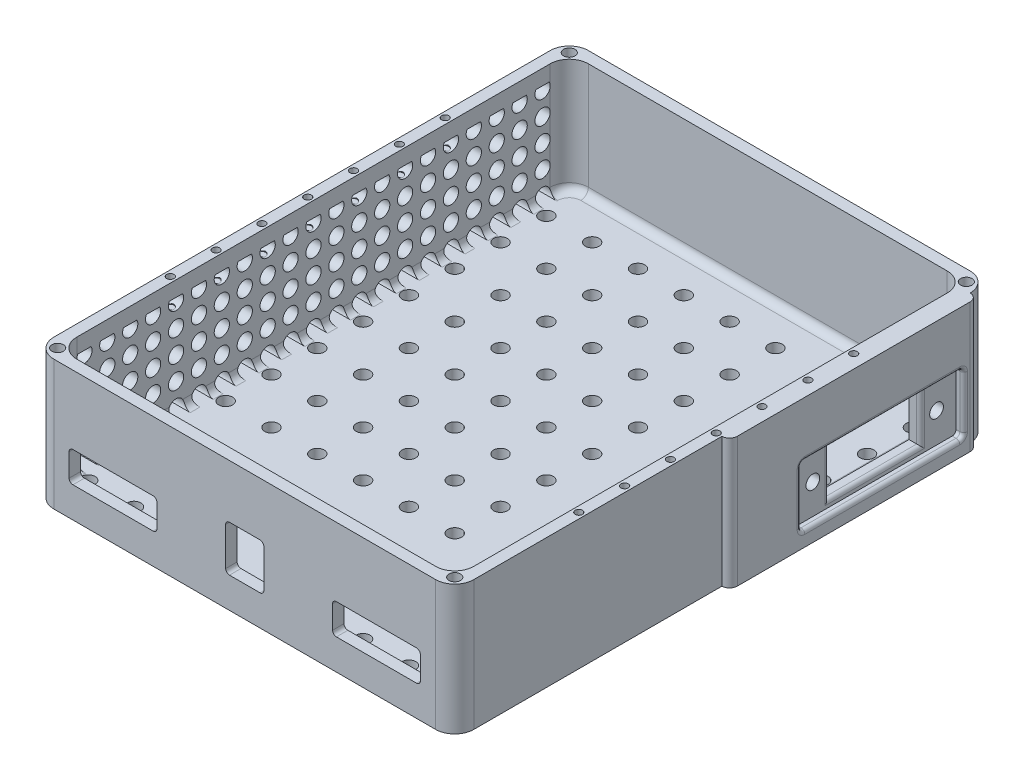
SolidWorks part; units mm, degrees
ref_plane "Front Plane" through (0, 0, 0) normal (0, 0, 1) x (1, 0, 0)
ref_plane "Top Plane" through (0, 0, 0) normal (0, 1, 0) x (1, 0, 0)
ref_plane "Right Plane" through (0, 0, 0) normal (1, 0, 0) x (0, 0, -1)
sketch "Sketch1" plane through (0, 0, 0) normal (0, 1, 0) x (1, 0, 0)
  line L1 (-55, 70) -> (55, 70)
  line L2 (-55, 70) -> (-55, -70)
  line L3 (-55, -70) -> (55, -70)
  line L4 (55, 70) -> (55, -70)
  line L5 (-55, 70) -> (55, -70) construction
  line L6 (-55, -70) -> (55, 70) construction
  point P0 (0, 0)
  dimension "D1" = 110
  dimension "D2" = 140
extrude "Boss-Extrude1" add sketch "Sketch1" along normal blind 4
sketch "Sketch3" plane through (0, 4, 0) normal (0, 1, 0) x (1, 0, 0)
  line L5 (-55, 70) -> (55, 70)
  line L6 (-55, 70) -> (-55, -70)
  line L7 (-55, -70) -> (55, -70)
  line L8 (52, -67) -> (52, 67)
  line L9 (52, 67) -> (-52, 67)
  line L10 (-52, 67) -> (-52, -67)
  line L11 (-52, -67) -> (52, -67)
  line L12 (52, -67) -> (52, 67)
  line L13 (52, 67) -> (-52, 67)
  line L14 (-52, 67) -> (-52, -67)
  line L15 (-52, -67) -> (52, -67)
  line L16 (55, 70) -> (55, -70)
  line L17 (-55, 70) -> (55, -70) construction
  line L18 (-55, -70) -> (55, 70) construction
  point P0 (0, 0)
  dimension "D1" = 3
extrude "Boss-Extrude2" add sketch "Sketch3" along normal blind 30
fillet "Fillet1" radius 5 8 edges at (55, 17, 70) (-55, 17, 70) (-52, 19, 67) (52, 19, 67) (55, 17, -70) (-55, 17, -70) (-52, 19, -67) (52, 19, -67)
sketch "Sketch5" plane through (0, 34, 0) normal (0, 1, 0) x (1, 0, 0)
  line L0 (-53.5355, 68.5355) -> (-50.5355, 65.5355)
  arc A2 (-50, 70) -> (-55, 65) centre (-50, 65) ccw construction
  arc A3 (-47, 67) -> (-52, 62) centre (-47, 62) ccw construction
  circle A4 centre (-52.0355, 67.0355) radius 1.5
  circle A5 centre (51.9645, 67.0355) radius 1.5
  circle A6 centre (51.9645, -66.9645) radius 1.5
  circle A7 centre (-52.0355, -66.9645) radius 1.5
  dimension "D1" = 3
  dimension "D2" = 2
  dimension "D3" = 2
extrude "Cut-Extrude2" cut sketch "Sketch5" against normal blind 7 contours A7 | A6 | A5 | A4
sketch "Sketch6" plane through (0, 34, 0) normal (0, 1, 0) x (1, 0, 0)
  line L0 (-52, 0) -> (-55, 0)
  line L1 (-52, 62) -> (-52, -62) construction
  line L2 (-55, 65) -> (-55, -65) construction
  line L3 (0, 67) -> (0, -67)
  line L4 (47, 67) -> (-47, 67) construction
  line L5 (-47, -67) -> (47, -67) construction
  circle A0 centre (-53.5, 0) radius 0.95
  circle A1 centre (-53.5, -12) radius 0.95
  circle A2 centre (-53.5, -24) radius 0.95
  circle A3 centre (-53.5, -36) radius 0.95
  circle A4 centre (-53.5, 0) radius 0.95
  circle A5 centre (-53.5, -12) radius 0.95
  circle A6 centre (-53.5, -24) radius 0.95
  circle A7 centre (-53.5, 12) radius 0.95
  circle A8 centre (-53.5, 0) radius 0.95
  circle A9 centre (-53.5, -12) radius 0.95
  circle A10 centre (-53.5, 24) radius 0.95
  circle A11 centre (-53.5, 12) radius 0.95
  circle A12 centre (-53.5, 0) radius 0.95
  circle A13 centre (-53.5, 12) radius 0.95
  circle A14 centre (-53.5, 24) radius 0.95
  circle A15 centre (-53.5, 36) radius 0.95
  circle A16 centre (53.5, -36) radius 0.95
  circle A17 centre (53.5, -24) radius 0.95
  circle A18 centre (53.5, -12) radius 0.95
  circle A19 centre (53.5, 0) radius 0.95
  circle A20 centre (53.5, 12) radius 0.95
  circle A21 centre (53.5, 24) radius 0.95
  circle A22 centre (53.5, 36) radius 0.95
  dimension "D1" = 1.9
  dimension "D2" = 4
  dimension "D3" = 4
extrude "Cut-Extrude3" cut sketch "Sketch6" against normal blind 7 contours A15 | A10 | A7 | A0 | A1 | A2 | A3 | A16 | A17 | A18 | A19 | A20 | A21 | A22
sketch "Sketch7" plane through (0, 4, 0) normal (0, 1, 0) x (1, 0, 0)
  line L0 (0, 67) -> (0, 57)
  line L1 (47, 67) -> (-47, 67) construction
  circle A0 centre (0, 57) radius 1.8
  circle A1 centre (12, 57) radius 1.8
  circle A2 centre (24, 57) radius 1.8
  circle A3 centre (36, 57) radius 1.8
  circle A4 centre (48, 57) radius 1.8
  circle A5 centre (0, 57) radius 1.8
  circle A6 centre (12, 57) radius 1.8
  circle A7 centre (24, 57) radius 1.8
  circle A8 centre (36, 57) radius 1.8
  circle A9 centre (-12, 57) radius 1.8
  circle A10 centre (0, 57) radius 1.8
  circle A11 centre (12, 57) radius 1.8
  circle A12 centre (24, 57) radius 1.8
  circle A13 centre (-24, 57) radius 1.8
  circle A14 centre (-12, 57) radius 1.8
  circle A15 centre (0, 57) radius 1.8
  circle A16 centre (12, 57) radius 1.8
  circle A17 centre (-36, 57) radius 1.8
  circle A18 centre (-24, 57) radius 1.8
  circle A19 centre (-12, 57) radius 1.8
  circle A20 centre (0, 57) radius 1.8
  circle A21 centre (-12, 57) radius 1.8
  circle A22 centre (-24, 57) radius 1.8
  circle A23 centre (-36, 57) radius 1.8
  circle A24 centre (-48, 57) radius 1.8
  point P6 (0, 0)
  dimension "D2" = 3.6
  dimension "D1" = 10
  dimension "D3" = 5
  dimension "D4" = 5
extrude "Cut-Extrude4" cut sketch "Sketch7" against normal blind 10
pattern_linear "LPattern1" count 11 spacing 12 along (0, 0, 1) of "Cut-Extrude4"
sketch "Sketch8" plane through (55, 0, 0) normal (1, 0, 0) x (0, 0, -1)
  line L0 (0, 0) -> (0, 34)
  line L1 (-65, 34) -> (65, 34) construction
  line L3 (0, 34) -> (65, 34)
  line L4 (0, 34) -> (0, 0)
  line L5 (0, 0) -> (65, 0)
  line L6 (65, 34) -> (65, 0)
extrude "Boss-Extrude3" add sketch "Sketch8" along normal blind 2 contours L0 M7 M8 M5
fillet "Fillet2" radius 2 2 edges at (57, 17, 0) (57, 17, -65)
sketch "Sketch9" plane through (57, 0, 0) normal (1, 0, 0) x (0, 0, -1)
  line L4 (32.5, 0) -> (32.5, 4)
  line L5 (2, 0) -> (63, 0) construction
  line L6 (61, 4) -> (4, 4)
  line L8 (61, 32) -> (4, 32)
  line L9 (4, 32) -> (4, 2)
  line L10 (4, 2) -> (61, 2)
  line L11 (61, 2) -> (61, 32)
  line L12 (61, 32) -> (4, 32)
  line L13 (4, 32) -> (4, 2)
  line L15 (61, 4) -> (61, 32)
  line L16 (19, 19.5) -> (61, 4)
  line L21 (61, 4) -> (19, 4)
  line L22 (61, 4) -> (61, 19.5)
  line L23 (61, 19.5) -> (19, 19.5)
  line L24 (19, 4) -> (19, 19.5)
  line L26 (28, 17.75) -> (52, 17.75)
  line L27 (28, 17.75) -> (28, 5.75)
  line L28 (28, 5.75) -> (52, 5.75)
  line L29 (52, 17.75) -> (52, 5.75)
  line L30 (28, 17.75) -> (52, 5.75) construction
  line L31 (28, 5.75) -> (52, 17.75) construction
  point P4 (40, 11.75)
  point P9 (32.5, 4)
  dimension "D2" = 4
  dimension "D3" = 15.5
  dimension "D4" = 42
  dimension "D5" = 24
  dimension "D6" = 12
  dimension "D1" = 2
extrude "Cut-Extrude5" cut sketch "Sketch9" against normal blind 12 contours L29 L16 L27 L28 | L29 L26 L27 L16
sketch "Sketch10" plane through (57, 0, 0) normal (1, 0, 0) x (0, 0, -1)
  line L0 (28, 17.75) -> (52, 5.75)
  line L1 (56.2, 11.75) -> (23.8, 11.75)
  line L2 (19, 19.5) -> (61, 19.5)
  line L3 (19, 19.5) -> (19, 4)
  line L4 (19, 4) -> (61, 4)
  line L5 (61, 19.5) -> (61, 4)
  line L6 (19, 19.5) -> (61, 4) construction
  line L7 (19, 4) -> (61, 19.5) construction
  circle A0 centre (23.8, 11.75) radius 1.8
  circle A1 centre (56.2, 11.75) radius 1.8
  point P4 (40, 11.75)
  point P12 (40, 11.75)
  dimension "D1" = 15.5
  dimension "D2" = 42
  dimension "D3" = 32.4
extrude "Cut-Extrude6" cut sketch "Sketch10" against normal blind 12
sketch "Sketch11" plane through (57, 0, 0) normal (1, 0, 0) x (0, 0, -1)
  line L0 (28, 17.75) -> (52, 5.75)
  line L2 (18.7, 19.6) -> (61.3, 19.6)
  line L3 (18.7, 19.6) -> (18.7, 3.9)
  line L4 (18.7, 3.9) -> (61.3, 3.9)
  line L5 (61.3, 19.6) -> (61.3, 3.9)
  line L6 (18.7, 19.6) -> (61.3, 3.9) construction
  line L7 (18.7, 3.9) -> (61.3, 19.6) construction
  point P4 (40, 11.75)
  dimension "D1" = 15.7
  dimension "D2" = 42.6
extrude "Cut-Extrude7" cut sketch "Sketch11" against normal blind 2 contours L5 L2 L3 L4 M7 M15 M12 M13 M14 M6
fillet "Fillet3" radius 1 4 edges at (56, 3.9, -18.7) (56, 19.6, -18.7) (56, 19.6, -61.3) (56, 3.9, -61.3)
fillet "Fillet4" radius 1 4 edges at (55, 17.75, -40) (55, 11.75, -52) (55, 11.75, -28) (55, 5.75, -40)
fillet "Fillet5" radius 1 8 edges at (57, 19.3071, -18.9929) (57, 11.75, -18.7) (57, 4.1929, -18.9929) (57, 3.9, -40) (57, 4.1929, -61.0071) (57, 11.75, -61.3) (57, 19.3071, -61.0071) (57, 19.6, -40)
sketch "Sketch12" plane through (0, 0, 70) normal (0, 0, 1) x (1, 0, 0)
  line L4 (-23, 8) -> (-23, 4)
  line L5 (-46, 4) -> (0, 4)
  line L6 (-46, 4) -> (-46, 8)
  line L7 (-46, 8) -> (0, 8)
  line L8 (-46, 4) -> (46, 4)
  line L9 (46, 4) -> (46, 30)
  line L10 (46, 30) -> (-46, 30)
  line L11 (-46, 30) -> (-46, 4)
  line L12 (-46, 4) -> (46, 4)
  line L13 (46, 4) -> (46, 30)
  line L14 (46, 30) -> (-46, 30)
  line L15 (-46, 30) -> (-46, 4)
  line L16 (0, 4) -> (0, 8)
  line L18 (-46, 8) -> (-23, 8)
  line L19 (-46, 8) -> (-46, 16)
  line L20 (-46, 16) -> (-23, 16)
  line L21 (-23, 8) -> (-23, 16)
  dimension "D2" = 8
  dimension "D1" = 4
extrude "Cut-Extrude8" cut sketch "Sketch12" against normal blind 22 contours L7 L21 L20 L15
fillet "Fillet6" radius 1 4 edges at (-23, 8, 68.5) (-46, 8, 68.5) (-23, 16, 68.5) (-46, 16, 68.5)
mirror "Mirror1" about plane through (0, 0, 0) normal (1, 0, 0) of "Fillet6", "Cut-Extrude8"
sketch "Sketch13" plane through (0, 0, 70) normal (0, 0, 1) x (1, 0, 0)
  line L0 (-45, 8) -> (45, 8)
  line L1 (0, 8) -> (0, 20)
  line L3 (-5, 20) -> (5, 20)
  line L4 (-5, 20) -> (-5, 8)
  line L5 (-5, 8) -> (5, 8)
  line L6 (5, 20) -> (5, 8)
  line L7 (-5, 20) -> (5, 8) construction
  line L8 (-5, 8) -> (5, 20) construction
  point P7 (0, 14)
  dimension "D1" = 12
  dimension "D2" = 10
extrude "Cut-Extrude9" cut sketch "Sketch13" against normal blind 12 contours L6 L3 L1 L0 | L3 L4 L0 L1
fillet "Fillet7" radius 1 4 edges at (5, 8, 68.5) (-5, 8, 68.5) (5, 20, 68.5) (-5, 20, 68.5)
fillet "Fillet8" radius 2 8 edges at (50.5355, 4, -65.5355) (52, 4, 0) (50.5355, 4, 65.5355) (0, 4, 67) (-50.5355, 4, 65.5355) (-52, 4, 0) (-50.5355, 4, -65.5355) (0, 4, -67)
sketch "Sketch14" plane through (-55, 0, 0) normal (-1, 0, 0) x (0, 0, 1)
  line L4 (0, 30) -> (0, 4)
  line L8 (-61, 4) -> (61, 4)
  line L9 (61, 4) -> (61, 30)
  line L10 (61, 30) -> (-61, 30)
  line L11 (-61, 30) -> (-61, 4)
  line L12 (-61, 4) -> (61, 4)
  line L13 (61, 4) -> (61, 30)
  line L14 (61, 30) -> (-61, 30)
  line L15 (-61, 30) -> (-61, 4)
  circle A0 centre (0, 17) radius 2
  circle A1 centre (0, 11) radius 2
  circle A2 centre (0, 5) radius 2
  circle A3 centre (0, 17) radius 2
  circle A4 centre (0, 11) radius 2
  circle A5 centre (0, 23) radius 2
  circle A6 centre (0, 17) radius 2
  circle A7 centre (0, 23) radius 2
  circle A8 centre (0, 29) radius 2
  dimension "D2" = 3
  dimension "D1" = 4
  dimension "D3" = 3
extrude "Cut-Extrude10" cut sketch "Sketch14" against normal blind 22 contours L4 A8 L14 | L14 A8 L4 | L4 A5 | L4 A5 | L4 A0 | L4 A0 | L4 A1 | L4 A1 | L4 A2 L12 | L12 A2 L4
pattern_linear "LPattern2" count 11 spacing 6 along (0, 0, -1) count 11 spacing 6 along (0, 0, 1) of "Cut-Extrude10"
